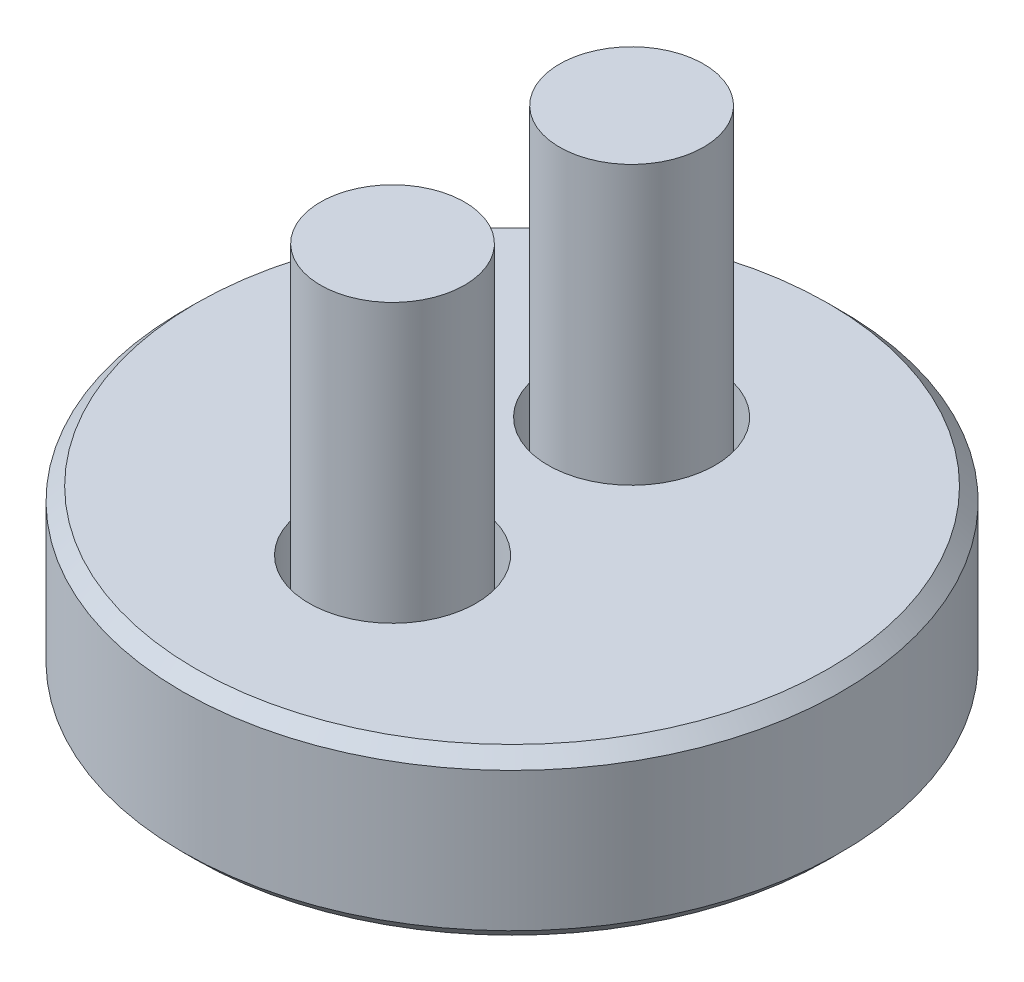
SolidWorks part; units mm, degrees
other "<LHCS8L.37>-<HEX>"
ref_plane "Front Plane" through (0, 0, 0) normal (0, 0, 1) x (1, 0, 0)
ref_plane "Top Plane" through (0, 0, 0) normal (0, 1, 0) x (1, 0, 0)
ref_plane "Right Plane" through (0, 0, 0) normal (1, 0, 0) x (0, 0, -1)
sketch "Sketch1" plane through (0, 0, 0) normal (0, 1, 0) x (1, 0, 0)
  circle A0 centre (0, 0) radius 9.525
  dimension "D1" = 19.05
extrude "Extrude1" add sketch "Sketch1" along normal blind 4.7752
chamfer "Chamfer1" distance 0.381 angle 45 2 edges at (0, 0, 9.525) (0, 4.7752, 9.525)
sketch "Sketch2" plane through (0, 0, 0) normal (0, -1, 0) x (1, 0, 0)
  line L0 (0, 3.4544) -> (0, 0) construction
  line L1 (0, 0) -> (0, -3.4544) construction
  circle A0 centre (0, 3.4544) radius 2.413
  circle A1 centre (0, -3.4544) radius 2.413
  dimension "D1" = 4.826
  dimension "D2" = 3.4544
extrude "Extrude2" cut sketch "Sketch2" against normal through all
sketch "Sketch3" plane through (0, 0, 0) normal (0, -1, 0) x (1, 0, 0)
  line L0 (0, -3.4544) -> (0, 3.4544) construction
  line L1 (4.064, -3.4544) -> (4.064, 3.4544)
  line L2 (-4.064, -3.4544) -> (-4.064, 3.4544)
  arc A0 (4.064, -3.4544) -> (-4.064, -3.4544) centre (0, -3.4544) cw
  arc A1 (4.064, 3.4544) -> (-4.064, 3.4544) centre (0, 3.4544) ccw
  dimension "D1" = 4.064
  dimension "D2" = 4.064
extrude "Extrude3" cut sketch "Sketch3" against normal blind 3.048
inserted part "LHCS8L.37"
move or copy body "Body-Move/Copy2" placed by mates yes
mirror "Mirror1" about plane through (0, 0, 0) normal (0, 0, 1)
